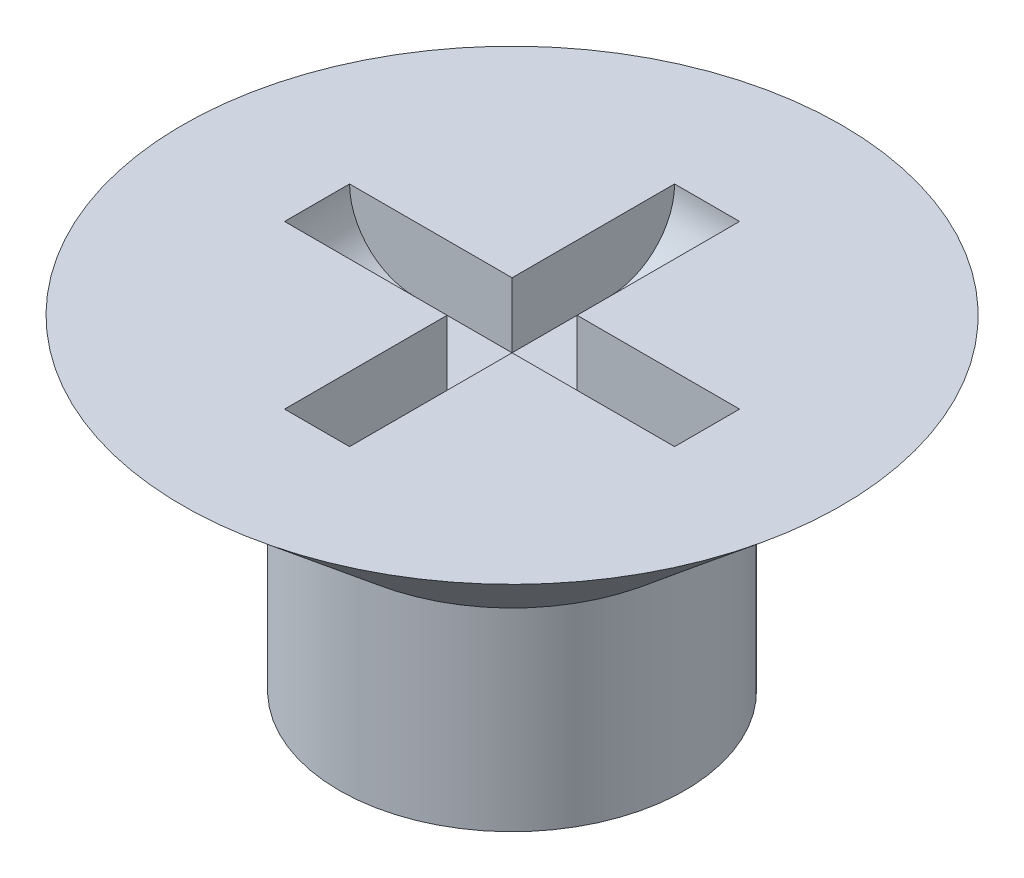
SolidWorks part; units mm, degrees
ref_plane "Front Plane" through (0, 0, 0) normal (0, 0, 1) x (1, 0, 0)
ref_plane "Top Plane" through (0, 0, 0) normal (0, 1, 0) x (1, 0, 0)
ref_plane "Right Plane" through (0, 0, 0) normal (1, 0, 0) x (0, 0, -1)
sketch "Sketch1" plane through (0, 0, 0) normal (1, 0, 0) x (0, 0, -1)
  line L0 (0, 0) -> (0, 6.35)
  line L1 (0, 6.35) -> (6.4389, 6.35)
  line L2 (6.4389, 6.35) -> (3.3782, 3.7846)
  line L3 (3.3782, 3.7846) -> (3.3782, 0)
  line L4 (3.3782, 0) -> (0, 0)
  dimension "D1" = 6.35
  dimension "D2" = 2.5654
  dimension "D3" = 6.4389
  dimension "D4" = 3.3782
revolve "Revolve1" add sketch "Sketch1" angle 360 about L0
sketch "Sketch2" plane through (0, 6.35, 0) normal (0, 1, 0) x (1, 0, 0)
  line L1 (-3.81, -0.635) -> (3.81, -0.635)
  line L2 (-3.81, -0.635) -> (-3.81, 0.635)
  line L3 (-3.81, 0.635) -> (3.81, 0.635)
  line L4 (3.81, -0.635) -> (3.81, 0.635)
  line L5 (-3.81, -0.635) -> (3.81, 0.635) construction
  line L6 (-3.81, 0.635) -> (3.81, -0.635) construction
  line L7 (-0.635, -3.81) -> (0.635, -3.81)
  line L8 (-0.635, -3.81) -> (-0.635, 3.81)
  line L9 (-0.635, 3.81) -> (0.635, 3.81)
  line L10 (0.635, -3.81) -> (0.635, 3.81)
  line L11 (-0.635, -3.81) -> (0.635, 3.81) construction
  line L12 (-0.635, 3.81) -> (0.635, -3.81) construction
  point P0 (0, 0)
  point P6 (0, 0)
  dimension "D1" = 7.62
  dimension "D2" = 1.27
extrude "Cut-Extrude1" cut sketch "Sketch2" against normal blind 1.27 contours L1 L8 L3 L2 | L1 L10 L3 L8 | L7 L10 L1 L8 | L10 L1 L4 L3 | L3 L10 L9 L8
fillet "Fillet1" radius 1.27 4 edges at (-3.81, 5.08, 0) (0, 5.08, -3.81) (3.81, 5.08, 0) (0, 5.08, 3.81)
